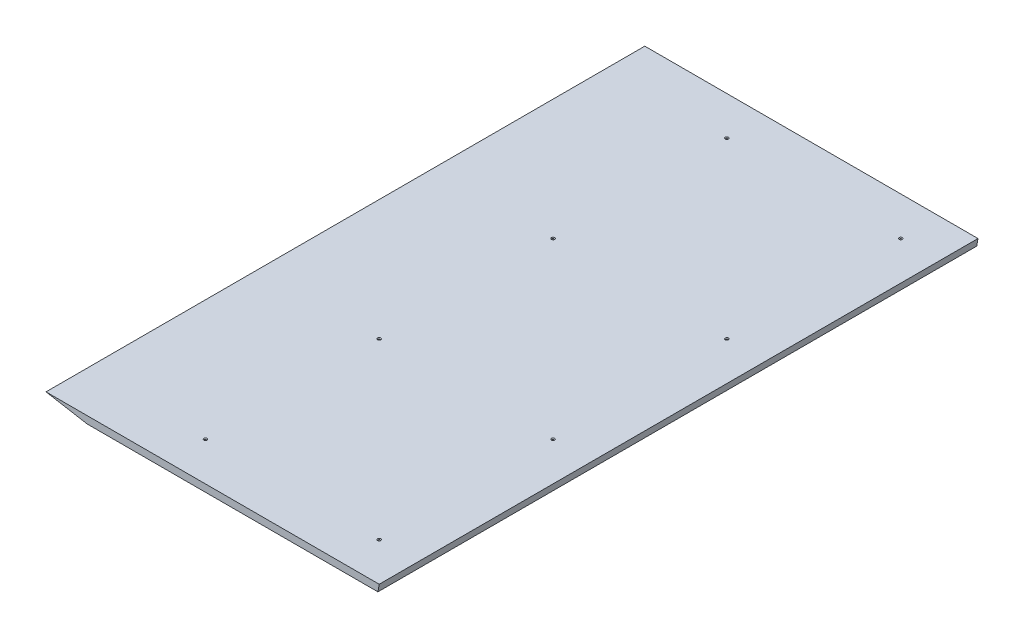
SolidWorks part; units mm, degrees
ref_plane "Front" through (0, 0, 0) normal (0, 0, 1) x (1, 0, 0)
ref_plane "Top" through (0, 0, 0) normal (0, 1, 0) x (1, 0, 0)
ref_plane "Right" through (0, 0, 0) normal (1, 0, 0) x (0, 0, -1)
sketch "Sketch1" plane through (0, 0, 0) normal (0, 1, 0) x (1, 0, 0)
  line L1 (0, 0) -> (876.3, 0)
  line L2 (0, 0) -> (0, 1574.8)
  line L3 (0, 1574.8) -> (876.3, 1574.8)
  line L4 (876.3, 0) -> (876.3, 1574.8)
  dimension "D1" = 1574.8
  dimension "D2" = 876.3
extrude "Boss-Extrude1" add sketch "Sketch1" along normal blind 19.05
sketch "Sketch2" plane through (0, 0, 0) normal (0, 0, 1) x (1, 0, 0)
  line L0 (0, 0) -> (0, 19.05)
  line L1 (0, 19.05) -> (0, 0) construction
  line L2 (0, 19.05) -> (876.3, 19.05) construction
  line L3 (0, 19.05) -> (108.0379, 0)
  line L4 (0, 0) -> (876.3, 0) construction
  line L5 (108.0379, 0) -> (0, 0)
  line L6 (876.3, 19.05) -> (876.3, 0)
  line L7 (876.3, 0) -> (872.941, 0)
  line L8 (872.941, 0) -> (876.3, 19.05)
  dimension "D1" = 10
  dimension "D2" = 10
extrude "Cut-Extrude1" cut sketch "Sketch2" against normal through all
sketch "Sketch3" plane through (0, 19.05, 0) normal (0, 1, 0) x (1, 0, 0)
  line L0 (876.3, 1574.8) -> (0, 1574.8) construction
  line L3 (876.3, 0) -> (876.3, 1574.8) construction
  point P0 (774.7, 1473.2)
  point P1 (774.7, 1016)
  point P2 (774.7, 558.8)
  point P3 (774.7, 101.6)
  point P4 (317.5, 101.6)
  point P5 (317.5, 558.8)
  point P6 (317.5, 1016)
  point P7 (317.5, 1473.2)
  dimension "D1" = 101.6
  dimension "D2" = 457.2
  dimension "D3" = 457.2
  dimension "D4" = 457.2
  dimension "D5" = 457.2
  dimension "D6" = 101.6
hole_wizard "CSK for #8 Flat Head Machine Screw (100)1" positions "Sketch4" profile "Sketch5" countersink size "#8" standard "ANSI Inch"
sketch "Sketch4" plane through (0, 19.05, 0) normal (0, 1, 0) x (1, 0, 0)
  point P0 (317.5, 1473.2)
  point P3 (774.7, 1473.2)
  point P6 (774.7, 1016)
  point P9 (774.7, 558.8)
  point P12 (774.7, 101.6)
  point P15 (317.5, 101.6)
  point P18 (317.5, 558.8)
  point P21 (317.5, 1016)
sketch "Sketch5" plane through (317.5, 19.05, -1473.2) normal (1, 0, 0) x (0, 0, 1)
  line L0 (0, 0) -> (0, 19.05)
  line L1 (0, 19.05) -> (2.2479, 19.05)
  line L2 (2.2479, 19.05) -> (2.2479, 1.6518)
  line L3 (2.2479, 1.6518) -> (4.2164, 0)
  line L5 (4.2164, 0) -> (0, 0)
  line L6 (-2.2479, 1.6518) -> (-4.2164, 0) construction
  line L11 (0, -6.35) -> (0, 107.95) construction
  dimension "Thru Hole Dia." = 4.4958
  dimension "Thru Hole Depth" = 19.05
  dimension "Near C'Sink Dia." = 8.4328
  dimension "Near C'Sink Angle" = 100
